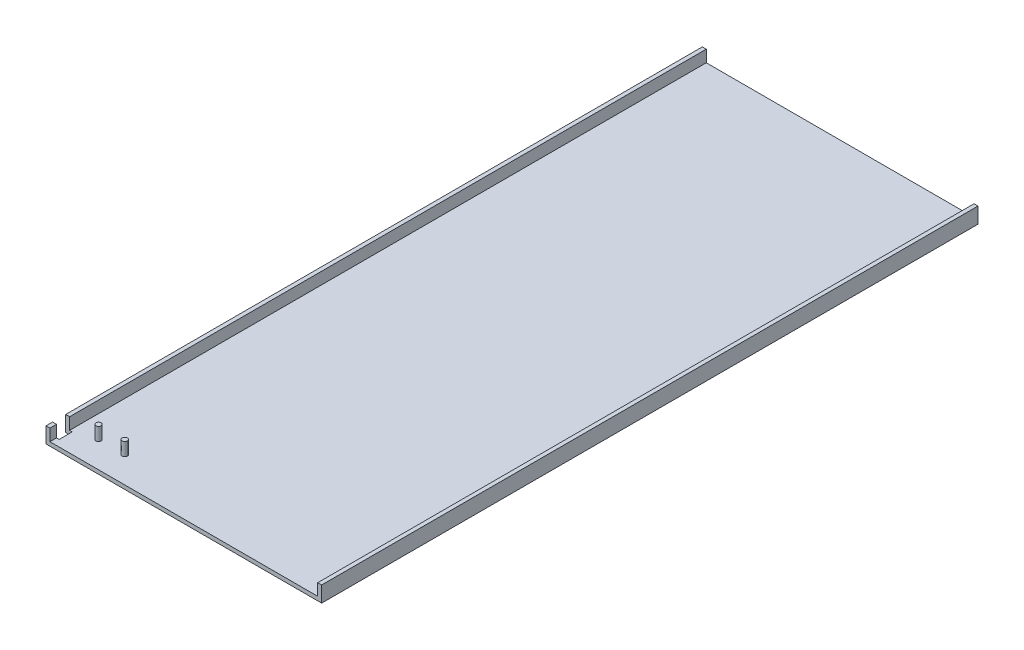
SolidWorks part; units mm, degrees
ref_plane "Ebene vorne" through (0, 0, 0) normal (0, 0, 1) x (1, 0, 0)
ref_plane "Ebene oben" through (0, 0, 0) normal (0, 1, 0) x (1, 0, 0)
ref_plane "Ebene rechts" through (0, 0, 0) normal (1, 0, 0) x (0, 0, -1)
sketch "Skizze1" plane through (0, 0, 0) normal (0, 0, 1) x (1, 0, 0)
  line L0 (0, 12) -> (0, 0)
  line L1 (0, 0) -> (210, 0)
  line L2 (210, 0) -> (210, 12)
  dimension "D1" = 210
  dimension "D2" = 12
  dimension "D3" = 12
extrude "Linear-Austragen-Dünn1" add sketch "Skizze1" along normal blind 500 thin
sketch "Skizze2" plane through (0, 3, 0) normal (0, 1, 0) x (1, 0, 0)
  line L0 (0, -500) -> (0, 0) construction
  line L1 (3, -500) -> (207, -500) construction
  circle A0 centre (20, -480) radius 2
  circle A1 centre (40, -480) radius 2
  dimension "D4" = 4
  dimension "D5" = 4
  dimension "D1" = 20
  dimension "D2" = 20
  dimension "D3" = 20
  dimension "D6" = 20
extrude "Aufsatz-Linear austragen1" add sketch "Skizze2" along normal blind 10
sketch "Skizze3" plane through (0, 0, 0) normal (-1, 0, 0) x (0, 0, 1)
  line L0 (500, 12) -> (0, 12) construction
  line L1 (495, 12) -> (485, 12)
  line L2 (495, 12) -> (495, 0)
  line L3 (495, 0) -> (485, 0)
  line L4 (485, 12) -> (485, 0)
  line L5 (500, 0) -> (0, 0) construction
  line L6 (500, 12) -> (500, 0) construction
  dimension "D1" = 5
  dimension "D2" = 10
extrude "Schnitt-Linear austragen1" cut sketch "Skizze3" against normal blind 5
